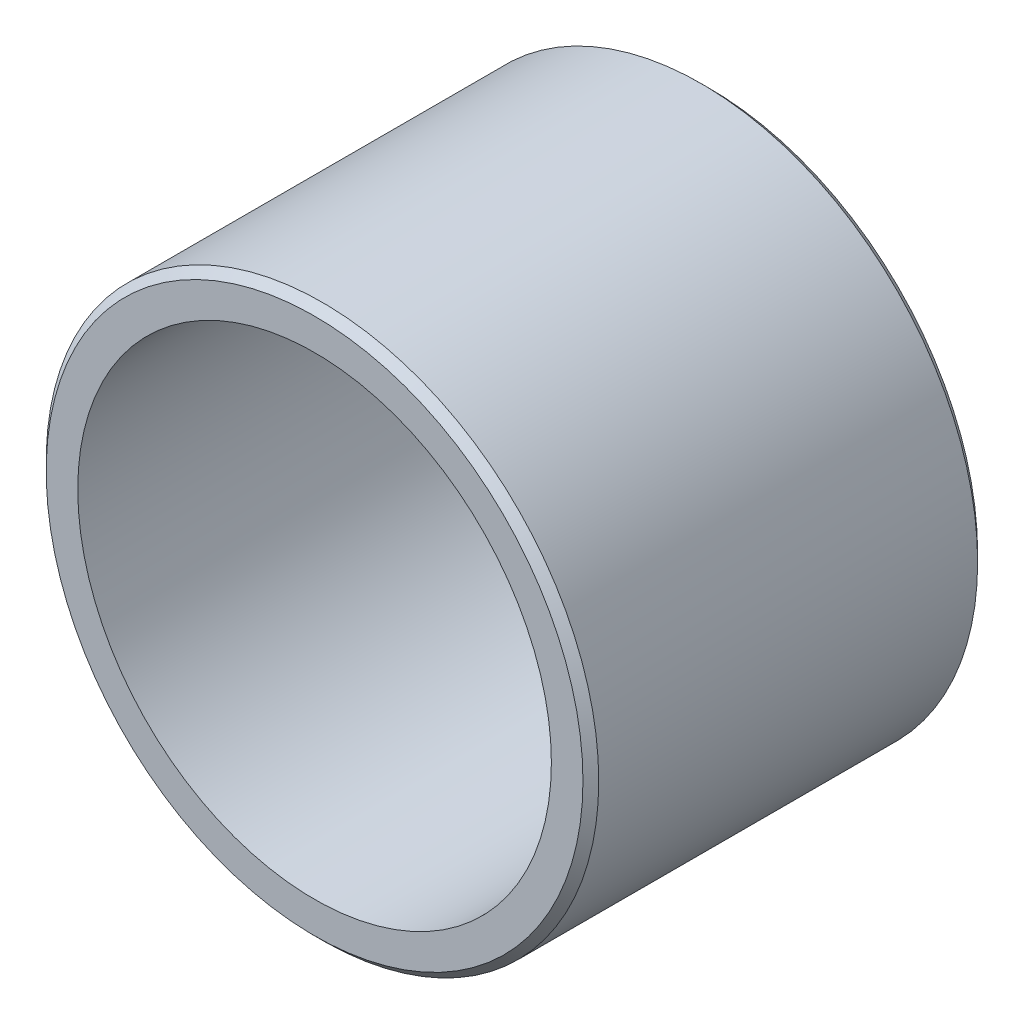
SolidWorks part; units mm, degrees
ref_plane "Plan1" through (0, 0, 0) normal (0, 0, 1) x (1, 0, 0)
ref_plane "Plan2" through (0, 0, 0) normal (0, 1, 0) x (1, 0, 0)
ref_plane "Plan3" through (0, 0, 0) normal (1, 0, 0) x (0, 0, -1)
sketch "Esquisse1" plane through (0, 0, 0) normal (0, 0, 1) x (1, 0, 0)
  circle A0 centre (0, 0) radius 7
  dimension "D1" = 14
extrude "Base-Extrusion" add sketch "Esquisse1" along normal blind 10
sketch "Esquisse2" plane through (0, 0, 0) normal (0, 0, -1) x (-1, 0, 0)
  circle A0 centre (0, 0) radius 6
  circle A1 centre (0, 0) radius 7 construction
  dimension "D1" = 12
extrude "Enlèv. mat.-Extru.1" cut sketch "Esquisse2" against normal through all
chamfer "Chanfrein1" distance 0.2 angle 45
chamfer "Chanfrein2" distance 0.2 angle 45
